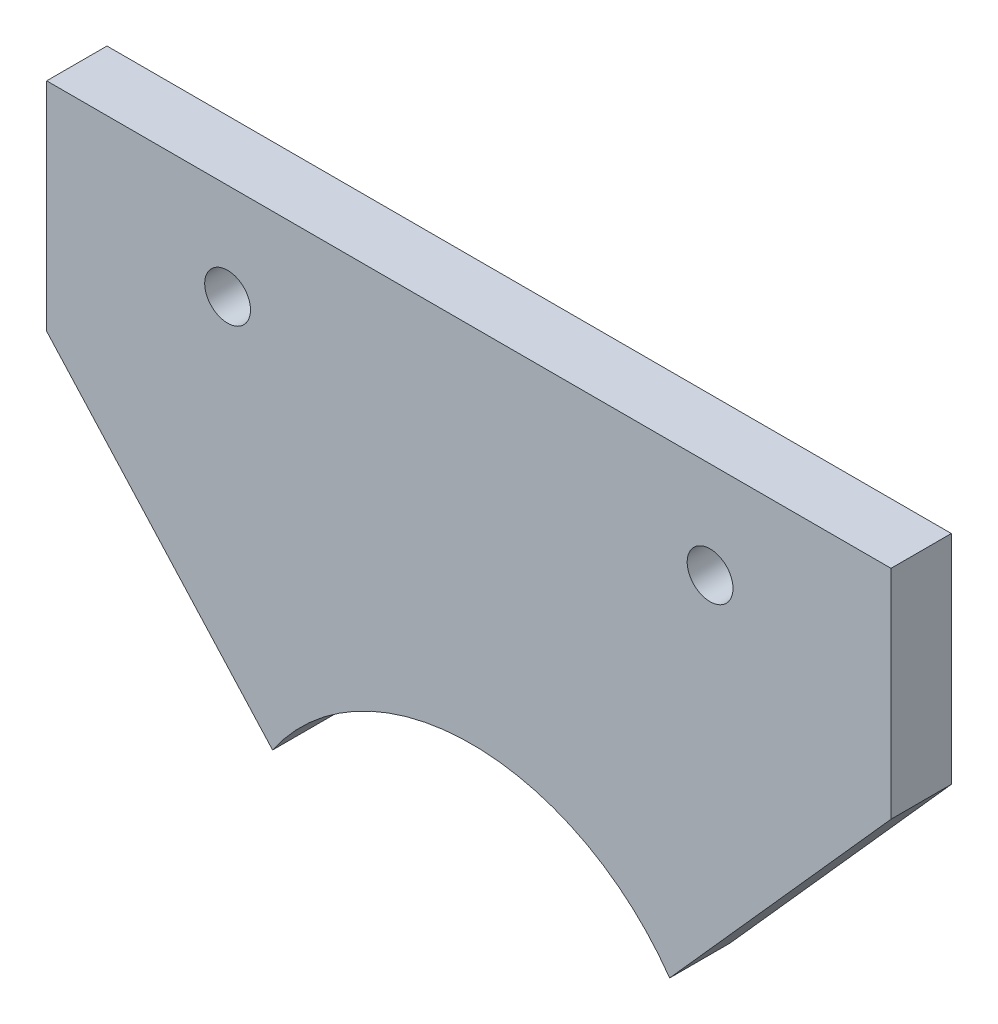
SolidWorks part; units mm, degrees
ref_plane "Front Plane" through (0, 0, 0) normal (0, 0, 1) x (1, 0, 0)
ref_plane "Top Plane" through (0, 0, 0) normal (0, 1, 0) x (1, 0, 0)
ref_plane "Right Plane" through (0, 0, 0) normal (1, 0, 0) x (0, 0, -1)
sketch "Sketch1" plane through (0, 0, 0) normal (0, 0, 1) x (1, 0, 0)
  line L1 (-35, -25) -> (35, -25)
  line L2 (-35, -25) -> (-35, 25)
  line L3 (-35, 25) -> (35, 25)
  line L4 (35, -25) -> (35, 25)
  line L5 (-35, -25) -> (35, 25) construction
  line L6 (-35, 25) -> (35, -25) construction
  point P0 (0, 0)
  dimension "D1" = 70
  dimension "D2" = 50
extrude "Boss-Extrude1" add sketch "Sketch1" along normal blind 5
hole_wizard "#6 Clearance Hole1" positions "Sketch3" profile "Sketch2" hole size "#6" standard "Ansi Inch"
sketch "Sketch3" plane through (0, 0, 5) normal (0, 0, 1) x (1, 0, 0)
  point P0 (-20, 17)
  point P1 (20, 17)
sketch "Sketch2" plane through (-20, 17, 5) normal (1, 0, 0) x (0, -1, 0)
  line L0 (0, 0) -> (0, 5)
  line L1 (0, 5) -> (1.8986, 5)
  line L2 (1.8986, 5) -> (1.8986, 0)
  line L5 (1.8986, 0) -> (0, 0)
  line L11 (0, -6.35) -> (0, 107.95) construction
  dimension "Thru Hole Dia." = 3.7973
  dimension "Thru Hole Depth" = 5
sketch "Sketch4" plane through (0, 0, 5) normal (0, 0, 1) x (1, 0, 0)
  line L0 (-54.8601, -6.9022) -> (-21.572, -43.6943)
  line L1 (-54.8601, -6.9022) -> (-37.0147, 9.2436)
  line L2 (-21.572, -43.6943) -> (-3.7267, -27.5485)
  line L3 (-37.0147, 9.2436) -> (-3.7267, -27.5485)
  line L4 (37.0147, 9.2436) -> (4.9209, -26.7378)
  line L5 (37.0147, 9.2436) -> (55.2782, -7.0467)
  line L6 (4.9209, -26.7378) -> (23.1844, -43.028)
  line L7 (55.2782, -7.0467) -> (23.1844, -43.028)
extrude "Cut-Extrude1" cut sketch "Sketch4" against normal through all
sketch "Sketch5" plane through (0, 0, 5) normal (0, 0, 1) x (1, 0, 0)
  line L0 (-6.0324, -25) -> (6.4709, -25) construction
  circle A0 centre (0.2192, -25) radius 20
extrude "Cut-Extrude2" cut sketch "Sketch5" against normal through all
